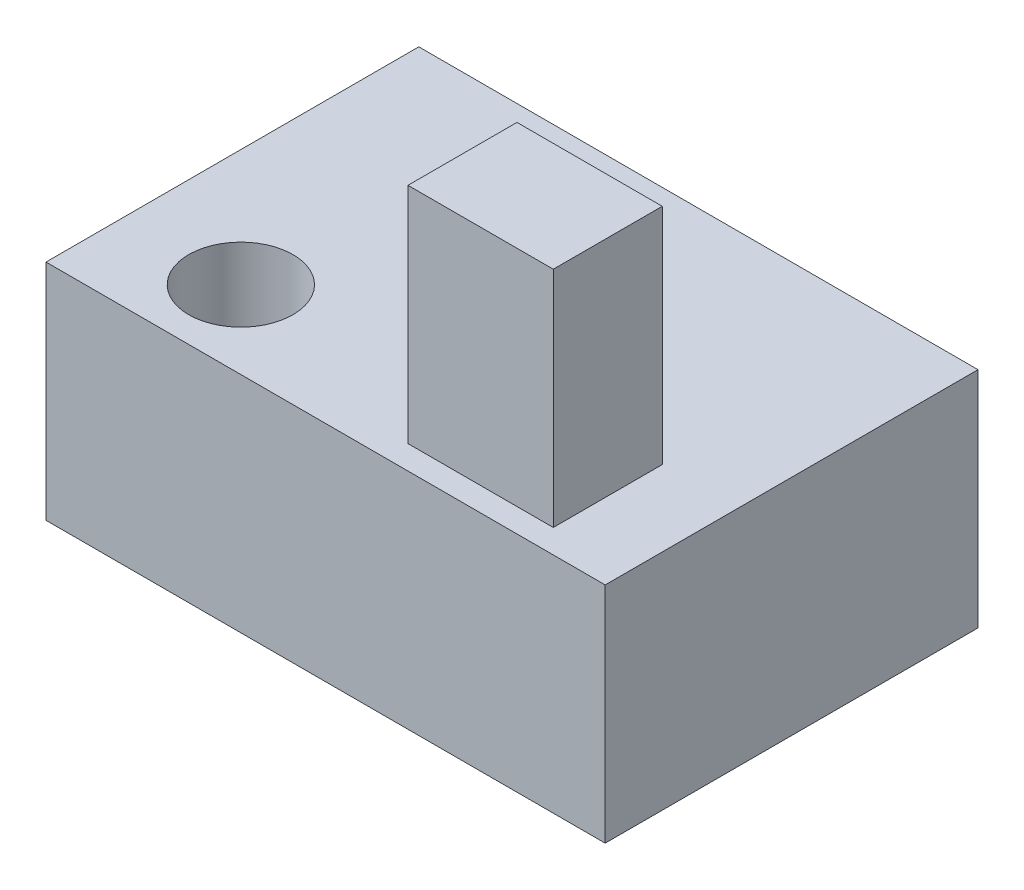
SolidWorks part; units mm, degrees
ref_plane "Front" through (0, 0, 0) normal (0, 0, 1) x (1, 0, 0)
ref_plane "Top" through (0, 0, 0) normal (0, 1, 0) x (1, 0, 0)
ref_plane "Right" through (0, 0, 0) normal (1, 0, 0) x (0, 0, -1)
sketch "Sketch5" plane through (0, 0, 0) normal (0, 1, 0) x (1, 0, 0)
  line L0 (75, -50) -> (-75, 50) construction
  line L1 (-75, 50) -> (75, 50)
  line L2 (-75, 50) -> (-75, -50)
  line L3 (-75, -50) -> (75, -50)
  line L4 (75, 50) -> (75, -50)
  dimension "D1" = 150
  dimension "D2" = 100
extrude "Extrude2" add sketch "Sketch5" along normal blind 60
sketch "Sketch6" plane through (0, 60, 0) normal (0, 1, 0) x (-1, 0, 0)
  line L1 (-54.6973, 43.625) -> (-15.7227, 43.625)
  line L2 (-54.6973, 43.625) -> (-54.6973, 14.394)
  line L3 (-54.6973, 14.394) -> (-15.7227, 14.394)
  line L4 (-15.7227, 43.625) -> (-15.7227, 14.394)
extrude "Extrude3" add sketch "Sketch6" along normal blind 60
sketch "Sketch7" plane through (0, 60, 0) normal (0, 1, 0) x (-1, 0, 0)
  circle A0 centre (43.6189, 29.1165) radius 13.9781
extrude "Cut-Extrude4" cut sketch "Sketch7" against normal blind 20
